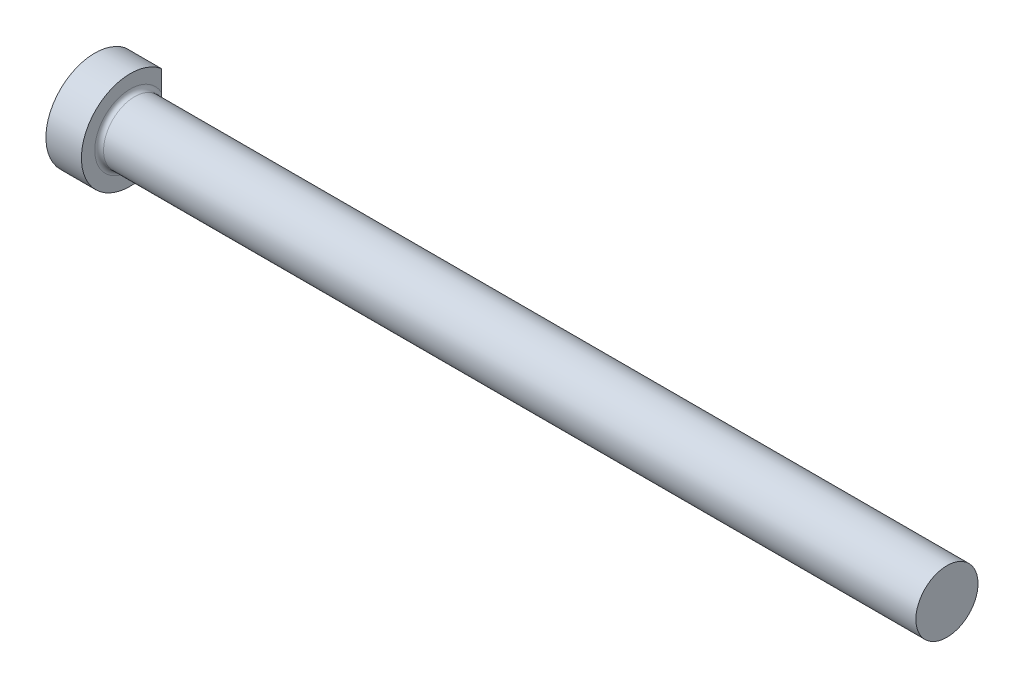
SolidWorks part; units mm, degrees
ref_plane "Front Plane" through (0, 0, 0) normal (0, 0, 1) x (1, 0, 0)
ref_plane "Top Plane" through (0, 0, 0) normal (0, 1, 0) x (1, 0, 0)
ref_plane "Right Plane" through (0, 0, 0) normal (1, 0, 0) x (0, 0, -1)
sketch "Sketch1" plane through (0, 0, 0) normal (0, 0, 1) x (1, 0, 0)
  line L0 (0, 0) -> (0, 8.7312)
  line L1 (0, 8.7312) -> (6.35, 8.7312)
  line L2 (6.35, 8.7312) -> (6.35, 6.3436)
  line L3 (7.1374, 5.5563) -> (152.4, 5.5562)
  line L4 (152.4, 5.5562) -> (152.4, 0)
  line L5 (152.4, 0) -> (0, 0)
  line L6 (152.4, 0) -> (0, 0) construction
  line L7 (0, 0) -> (-10.4771, 0) construction
  line L8 (152.4, 0) -> (1002.3976, 0) construction
  line L9 (7.1374, 5.5563) -> (-7.9138, 5.5562) construction
  arc A0 (7.1374, 5.5563) -> (6.35, 6.3436) centre (7.1374, 6.3436) cw
  dimension "D1" = 0.7874
  dimension "HeadDia" = 17.4625
  dimension "HeadThickness" = 6.35
  dimension "PinDia" = 11.1125
  dimension "overall" = 152.4
revolve "PIN" add sketch "Sketch1" angle 360 about L6
ref_plane "Plane1" through (79.7687, 0, -5.5563) normal (0, 0, -1) x (0, -1, 0)
ref_plane "CutPlane" through (0, 0, -5.5565) normal (0, 0, -1) x (-1, 0, 0)
other "SurfaceCut1"
